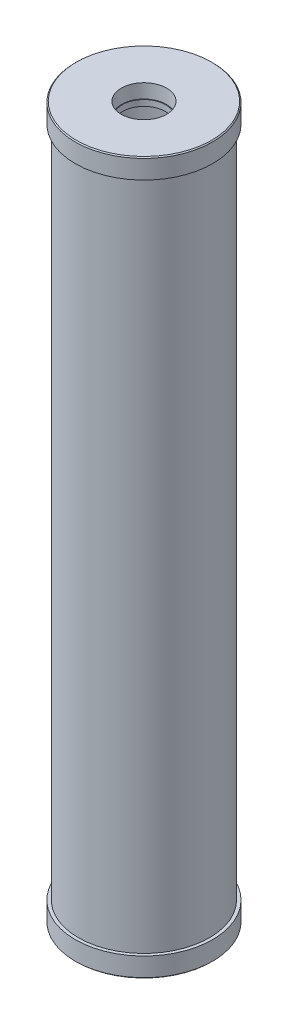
SolidWorks part; units mm, degrees
ref_plane "Front Plane" through (0, 0, 0) normal (0, 0, 1) x (1, 0, 0)
ref_plane "Top Plane" through (0, 0, 0) normal (0, 1, 0) x (1, 0, 0)
ref_plane "Right Plane" through (0, 0, 0) normal (1, 0, 0) x (0, 0, -1)
sketch "Sketch1" plane through (0, 0, 0) normal (0, 1, 0) x (1, 0, 0)
  circle A0 centre (0, 0) radius 84.201
  circle A1 centre (0, 0) radius 74.676
  dimension "D1" = 168.402
  dimension "D2" = 9.525
extrude "Boss-Extrude1" add sketch "Sketch1" along normal blind 914.4
ref_plane "Plane1" through (0, 914.4, 0) normal (0, 1, 0) x (1, 0, 0)
sketch "Sketch2" plane through (0, 0, 0) normal (0, 1, 0) x (1, 0, 0)
  circle A0 centre (0, 0) radius 88.265
  dimension "D1" = 176.53
extrude "Boss-Extrude2" add sketch "Sketch2" along normal blind 25.4
sketch "Sketch3" plane through (0, 914.4, 0) normal (0, 1, 0) x (1, 0, 0)
  circle A0 centre (0, 0) radius 88.265
  dimension "D1" = 176.53
extrude "Boss-Extrude3" add sketch "Sketch3" against normal blind 25.4
hole_wizard "2 NPT Tapped Hole1" positions "Sketch5" profile "Sketch4" size "2" standard "ANSI Inch"
sketch "Sketch5" plane through (0, 914.4, 0) normal (0, 1, 0) x (1, 0, 0)
  point P0 (0, 0)
sketch "Sketch4" plane through (0, 914.4, 0) normal (1, 0, 0) x (0, 0, 1)
  line L0 (0, 0) -> (0, 45.6525)
  line L1 (27.7876, 28.956) -> (0, 45.6525)
  line L2 (-27.7876, 28.956) -> (0, 45.6525) construction
  line L3 (27.7876, 28.956) -> (27.7876, 17.78)
  line L4 (27.7876, 17.78) -> (28.6326, 17.78)
  line L5 (28.6326, 17.78) -> (29.165, 0)
  line L6 (-28.6326, 17.78) -> (-29.165, 0) construction
  line L7 (29.165, 0) -> (0, 0)
  line L8 (0, -6.35) -> (0, 107.95) construction
  line L11 (-27.7876, 17.78) -> (-28.6326, 17.78) construction
  dimension "Tap Drill Dia." = 55.5752
  dimension "Tap Drill Depth" = 28.956
  dimension "Thread Dia." = 58.33
  dimension "Thread Angle" = 3.43
  dimension "Thread Depth" = 17.78
  dimension "Drill Angle" = 118
hole_wizard "2 NPT Tapped Hole3" positions "Sketch11" profile "Sketch10" size "2" standard "ANSI Inch"
sketch "Sketch11" plane through (0, 0, 0) normal (0, 1, 0) x (1, 0, 0)
  point P0 (0, 0)
sketch "Sketch10" plane through (0, 0, 0) normal (1, 0, 0) x (0, 0, -1)
  line L0 (0, 0) -> (0, 45.6525)
  line L1 (27.7876, 28.956) -> (0, 45.6525)
  line L2 (-27.7876, 28.956) -> (0, 45.6525) construction
  line L3 (27.7876, 28.956) -> (27.7876, 17.78)
  line L4 (27.7876, 17.78) -> (28.6326, 17.78)
  line L5 (28.6326, 17.78) -> (29.165, 0)
  line L6 (-28.6326, 17.78) -> (-29.165, 0) construction
  line L7 (29.165, 0) -> (0, 0)
  line L8 (0, -6.35) -> (0, 107.95) construction
  line L11 (-27.7876, 17.78) -> (-28.6326, 17.78) construction
  dimension "Tap Drill Dia." = 55.5752
  dimension "Tap Drill Depth" = 28.956
  dimension "Thread Dia." = 58.33
  dimension "Thread Angle" = 3.43
  dimension "Thread Depth" = 17.78
  dimension "Drill Angle" = 118
chamfer "Chamfer1" distance 1.27 angle 45 2 edges at (0, 0, 88.265) (0, 914.4, 88.265)
